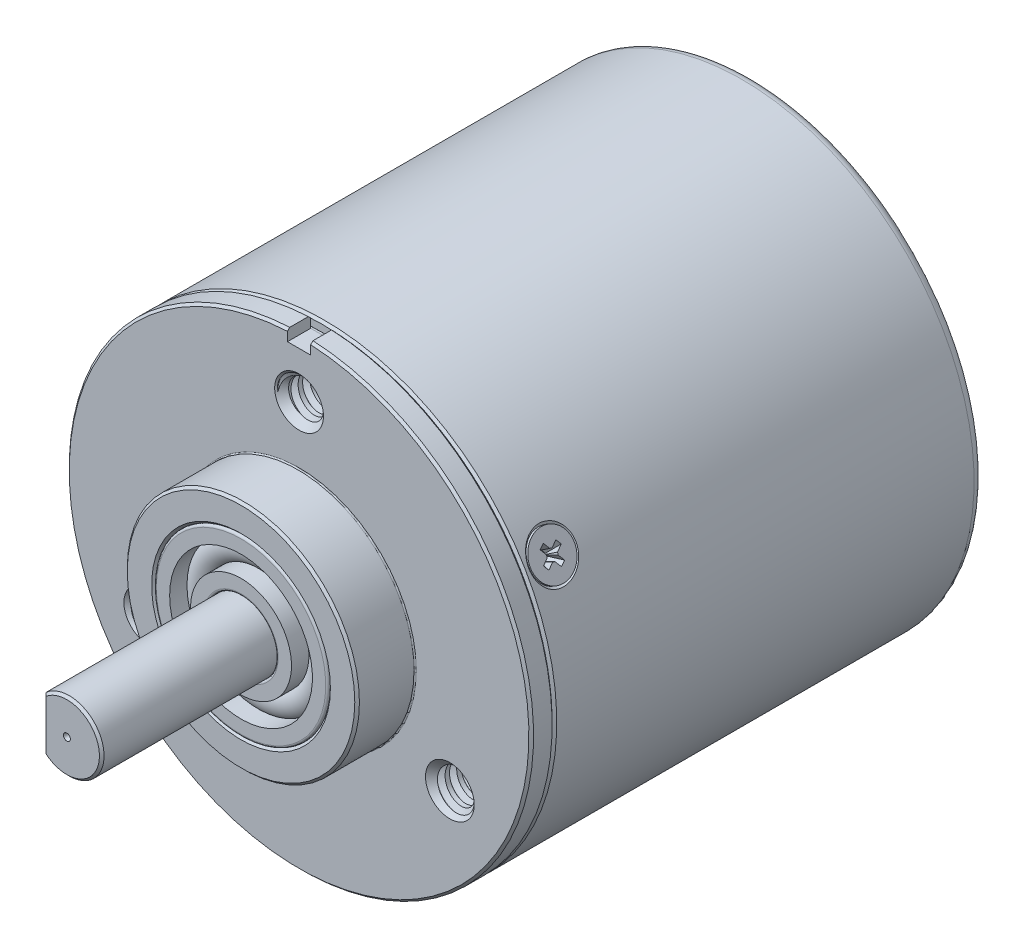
SolidWorks part; units mm, degrees
other "countersunk flat head cross recess screw_iso-5-sólido1"
other "countersunk flat head cross recess screw_iso-4-sólido1"
other "countersunk flat head cross recess screw_iso-3-sólido1"
other "E6B2-CWZ6C-3-1-sólido1"
other "instrument ball bearing_68_iso-1-sólido1"
other "E6B2-CWZ6C-2-1-sólido1"
other "E6B2-CWZ6C-1-1-sólido1"
ref_plane "Front Plane" through (0, 0, 0) normal (0, 0, 1) x (1, 0, 0)
ref_plane "Top Plane" through (0, 0, 0) normal (0, 1, 0) x (1, 0, 0)
ref_plane "Right Plane" through (0, 0, 0) normal (1, 0, 0) x (0, 0, -1)
other "Hacer pieza multicuerpo1"
